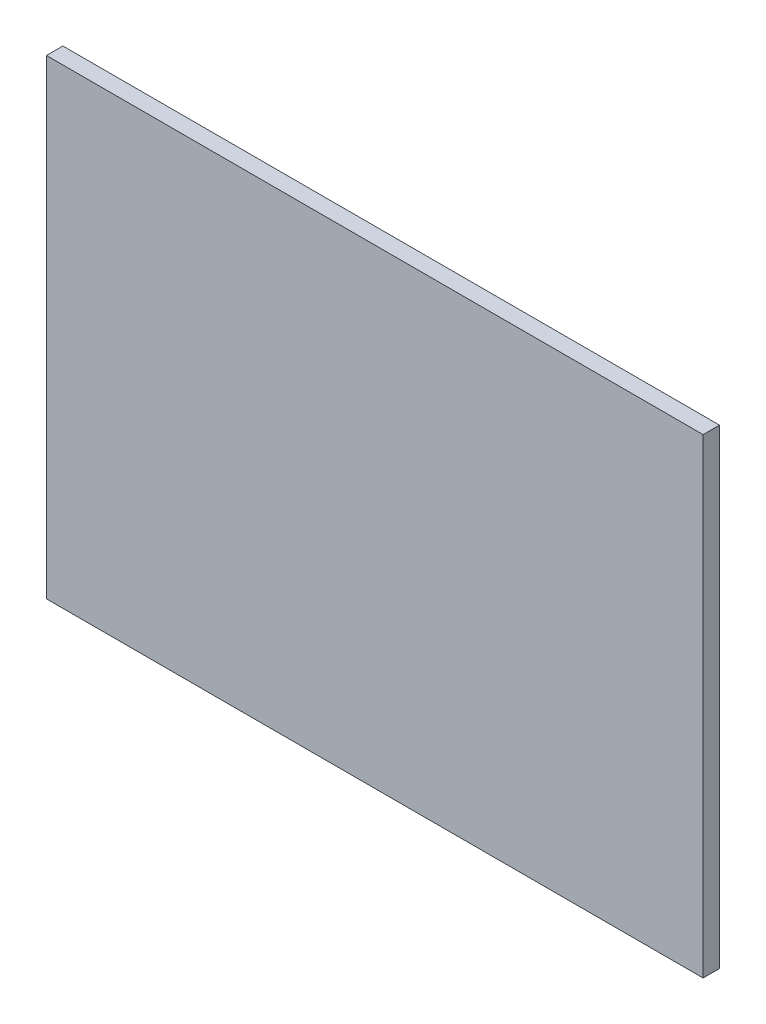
SolidWorks part; units mm, degrees
ref_plane "Alzado" through (0, 0, 0) normal (0, 0, 1) x (1, 0, 0)
ref_plane "Planta" through (0, 0, 0) normal (0, 1, 0) x (1, 0, 0)
ref_plane "Vista lateral" through (0, 0, 0) normal (1, 0, 0) x (0, 0, -1)
sketch "Croquis1" plane through (0, 0, 0) normal (0, 0, 1) x (1, 0, 0)
  line L1 (-300, 215) -> (300, 215)
  line L2 (-300, 215) -> (-300, -215)
  line L3 (-300, -215) -> (300, -215)
  line L4 (300, 215) -> (300, -215)
  line L5 (-300, 215) -> (300, -215) construction
  line L6 (-300, -215) -> (300, 215) construction
  point P1 (0, 0)
  dimension "D1" = 600
  dimension "D2" = 430
extrude "Saliente-Extruir1" add sketch "Croquis1" along normal blind 15
